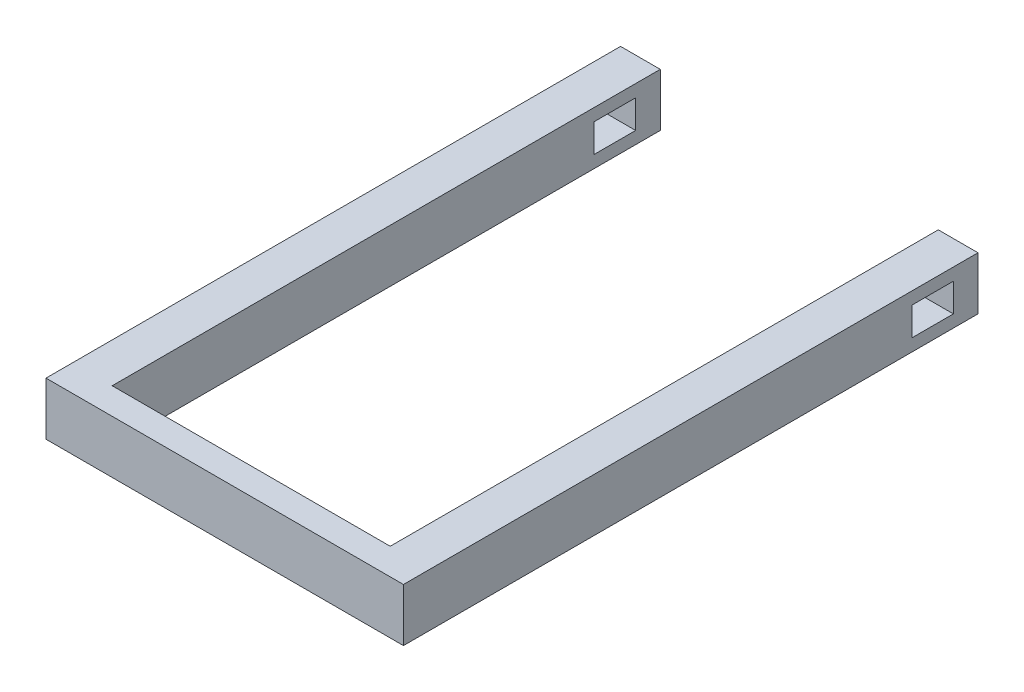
SolidWorks part; units mm, degrees
ref_plane "Ebene vorne" through (0, 0, 0) normal (0, 0, 1) x (1, 0, 0)
ref_plane "Ebene oben" through (0, 0, 0) normal (0, 1, 0) x (1, 0, 0)
ref_plane "Ebene rechts" through (0, 0, 0) normal (1, 0, 0) x (0, 0, -1)
sketch "Skizze1" plane through (0, 0, 0) normal (0, 1, 0) x (1, 0, 0)
  line L0 (-13.5, 43.4) -> (-13.5, 0)
  line L1 (-13.5, 0) -> (13.5, 0)
  line L2 (13.5, 0) -> (13.5, 43.4)
  line L3 (13.5, 43.4) -> (10.5, 43.4)
  line L4 (10.5, 43.4) -> (10.5, 2)
  line L5 (10.5, 2) -> (-10.5, 2)
  line L6 (-10.5, 2) -> (-10.5, 43.4)
  line L7 (-10.5, 43.4) -> (-13.5, 43.4)
  line L8 (0, 33.1352) -> (0, -33.6045) construction
  line L9 (0, -55) -> (0, 55) construction
  line L12 (-55, 0) -> (55, 0) construction
  dimension "D1" = 21
  dimension "D2" = 3
  dimension "D3" = 3
  dimension "D5" = 2
  dimension "D6" = 41.4
extrude "Aufsatz-Linear austragen1" add sketch "Skizze1" along normal blind 4
sketch "Skizze2" plane through (13.5, 0, 0) normal (1, 0, 0) x (0, 0, -1)
  line L0 (43.4, 4) -> (43.4, 0) construction
  line L1 (0, 2.2) -> (0, -2.2) construction
  line L2 (38.4, 3.07) -> (41.54, 3.07)
  line L3 (38.4, 3.07) -> (38.4, 0.93)
  line L4 (38.4, 0.93) -> (41.54, 0.93)
  line L5 (41.54, 3.07) -> (41.54, 0.93)
  line L7 (43.4, 2) -> (29.8639, 2) construction
  dimension "D1" = 3.14
  dimension "D2" = 38.4
  dimension "D3" = 2.14
extrude "Schnitt-Linear austragen1" cut sketch "Skizze2" against normal through all
